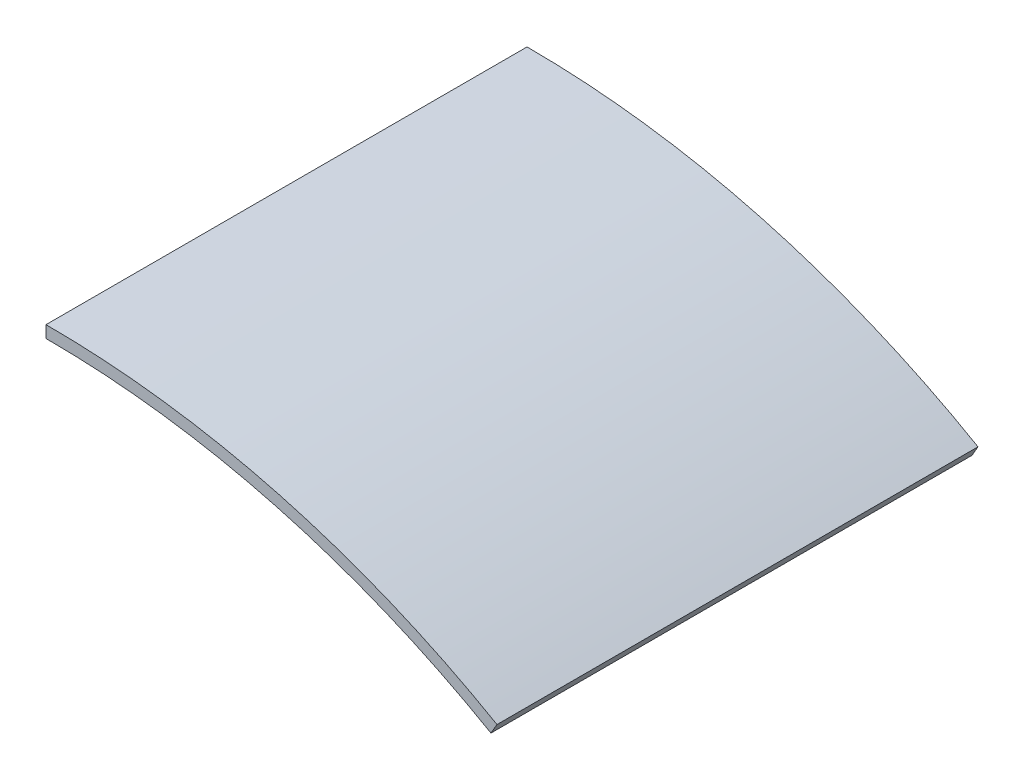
SolidWorks part; units mm, degrees
ref_plane "Vorne" through (0, 0, 0) normal (0, 0, 1) x (1, 0, 0)
ref_plane "Oben" through (0, 0, 0) normal (0, 1, 0) x (1, 0, 0)
ref_plane "Rechts" through (0, 0, 0) normal (1, 0, 0) x (0, 0, -1)
sketch "Skizze1" plane through (0, 0, 0) normal (0, 0, 1) x (1, 0, 0)
  line L0 (0, 0) -> (0, 37.5) construction
  line L1 (0, 0) -> (18.75, 32.476) construction
  arc A0 (18.75, 32.476) -> (0, 37.5) centre (0, 0) ccw
  dimension "D1" = 75
  dimension "D2" = 30
extrude "Linear-Austragen-Dünn1" add sketch "Skizze1" along normal blind 20 thin
